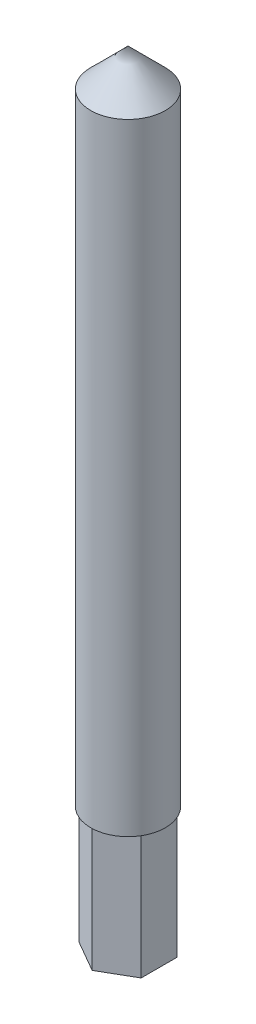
SolidWorks part; units mm, degrees
ref_plane "Front Plane" through (0, 0, 0) normal (0, 0, 1) x (1, 0, 0)
ref_plane "Top Plane" through (0, 0, 0) normal (0, 1, 0) x (1, 0, 0)
ref_plane "Right Plane" through (0, 0, 0) normal (1, 0, 0) x (0, 0, -1)
sketch "Sketch1" plane through (0, 0, 0) normal (0, 1, 0) x (1, 0, 0)
  circle A0 centre (0, 0) radius 6
  dimension "D1" = 12
extrude "Extrude1" add sketch "Sketch1" along normal blind 120
sketch "Sketch2" plane through (0, 0, 0) normal (0, -1, 0) x (1, 0, 0)
  line L0 (0, 6.4242) -> (0, -6.4683) construction
  line L1 (0, 5.7735) -> (5, 2.8868)
  line L2 (5.8281, 3.3649) -> (0, 0) construction
  line L3 (5, 2.8868) -> (5, -2.8868)
  line L4 (5, -2.8868) -> (0, -5.7735)
  line L5 (0, -5.7735) -> (-5, -2.8868)
  line L6 (-5, -2.8868) -> (-5, 2.8868)
  line L7 (-5, 2.8868) -> (0, 5.7735)
  circle A0 centre (0, 0) radius 6 construction
  circle A1 centre (0, 0) radius 6
  dimension "D1" = 60
  dimension "D2" = 10
extrude "Cut-Extrude1" cut sketch "Sketch2" against normal blind 20
sketch "Sketch3" plane through (0, 0, 0) normal (1, 0, 0) x (0, 0, -1)
  line L0 (6, 120) -> (-6, 120) construction
  line L1 (6, 120) -> (0, 120)
  line L2 (0, 120) -> (0, 126)
  line L3 (0, 120) -> (0, 20) construction
  line L4 (0, 126) -> (6, 120)
  line L5 (0, 117.3734) -> (0, 133.5133) construction
  dimension "D1" = 45
revolve "Revolve1" add sketch "Sketch3" angle 360 about L5
